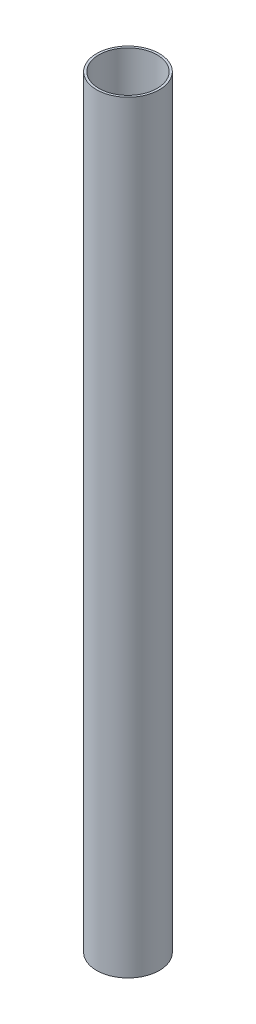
SolidWorks part; units mm, degrees
ref_plane "Front Plane" through (0, 0, 0) normal (0, 0, 1) x (1, 0, 0)
ref_plane "Top Plane" through (0, 0, 0) normal (0, 1, 0) x (1, 0, 0)
ref_plane "Right Plane" through (0, 0, 0) normal (1, 0, 0) x (0, 0, -1)
sketch "Sketch1" plane through (0, 0, 0) normal (0, 1, 0) x (1, 0, 0)
  circle A0 centre (0, 0) radius 17.4625
  circle A1 centre (0, 0) radius 18.8087
  dimension "D1" = 37.6174
  dimension "D2" = 34.925
extrude "Boss-Extrude1" add sketch "Sketch1" along normal blind 457.2
